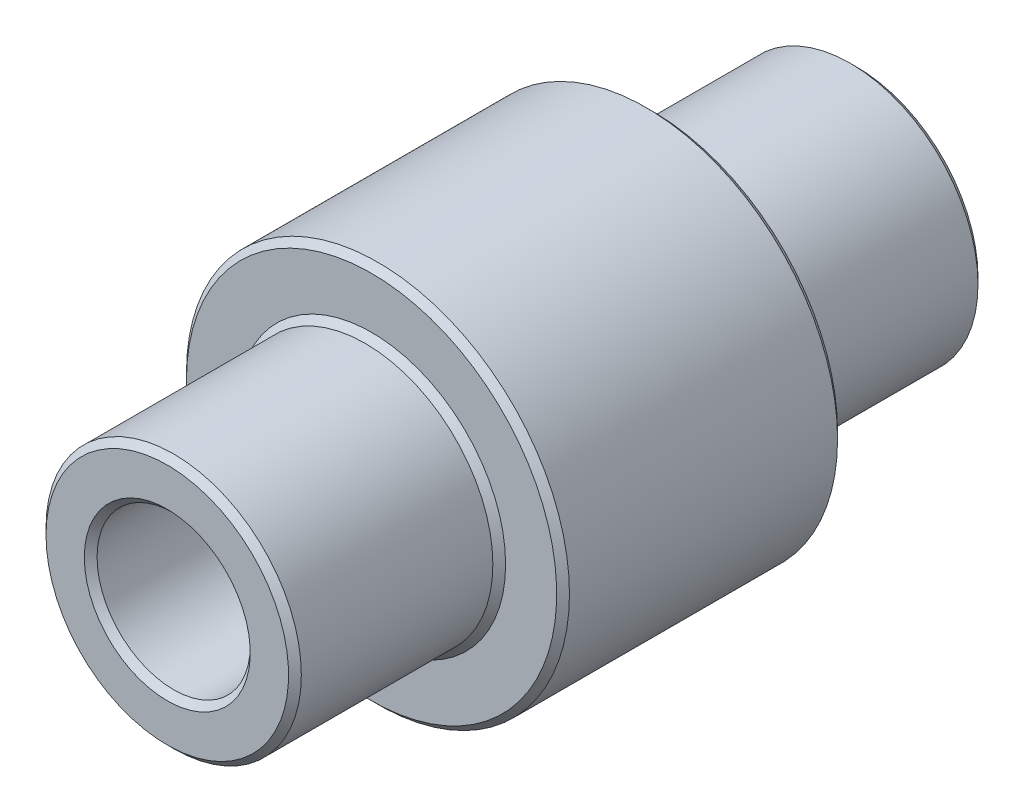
SolidWorks part; units mm, degrees
ref_plane "Спереди" through (0, 0, 0) normal (0, 0, 1) x (1, 0, 0)
ref_plane "Сверху" through (0, 0, 0) normal (0, 1, 0) x (1, 0, 0)
ref_plane "Справа" through (0, 0, 0) normal (1, 0, 0) x (0, 0, -1)
sketch "Эскиз1" plane through (0, 0, 0) normal (1, 0, 0) x (0, 0, -1)
  line L0 (-27, 0) -> (27, 0) construction
  line L1 (-27, 6) -> (-27, 10)
  line L2 (-27, 10) -> (-11, 10)
  line L3 (-11, 10) -> (-11, 15)
  line L4 (-11, 15) -> (11, 15)
  line L5 (11, 15) -> (11, 10)
  line L6 (11, 10) -> (27, 10)
  line L7 (27, 10) -> (27, 6)
  line L8 (27, 6) -> (-27, 6)
  dimension "D1" = 54
  dimension "D2" = 12
  dimension "D3" = 20
  dimension "D4" = 30
  dimension "D5" = 22
revolve "Повернуть1" add sketch "Эскиз1" angle 360 about L0
chamfer "Фаска1" distance 0.5 angle 45 8 edges at (15, 0, -11) (15, 0, 11) (10, 0, -27) (10, 0, -11) (10, 0, 11) (10, 0, 27) (6, 0, 27) (6, 0, -27)
